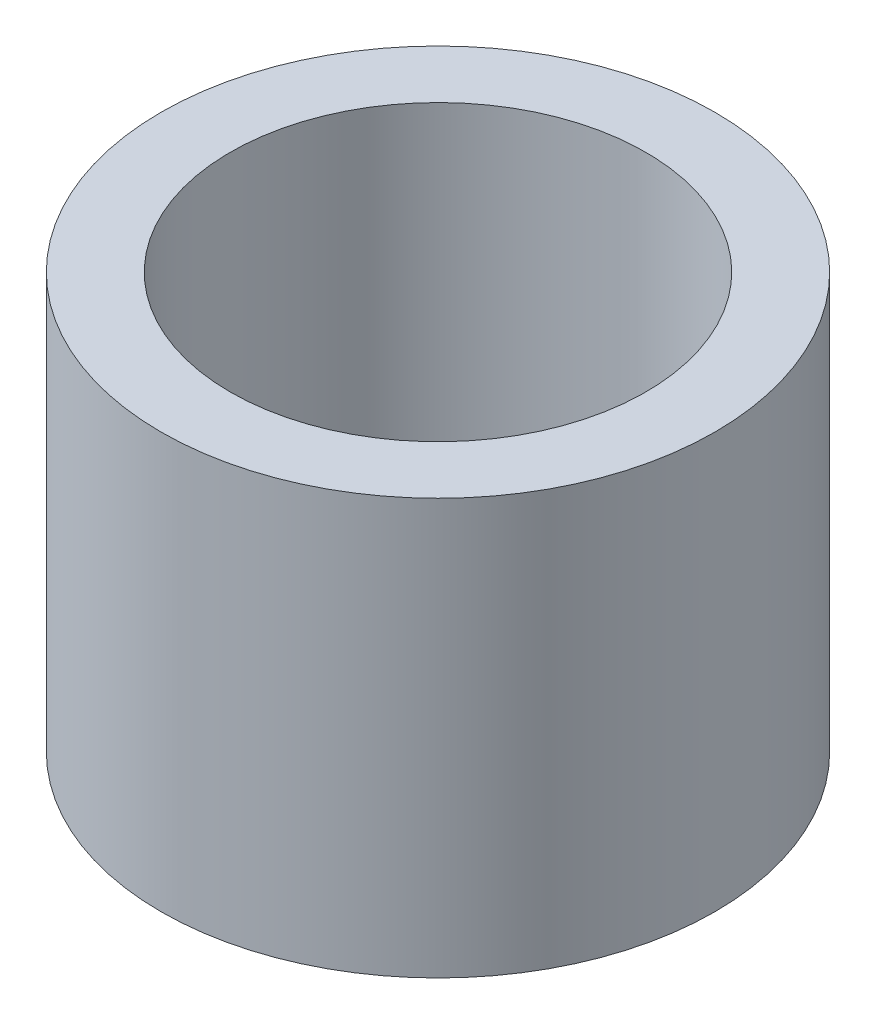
SolidWorks part; units mm, degrees
ref_plane "Front Plane" through (0, 0, 0) normal (0, 0, 1) x (1, 0, 0)
ref_plane "Top Plane" through (0, 0, 0) normal (0, 1, 0) x (1, 0, 0)
ref_plane "Right Plane" through (0, 0, 0) normal (1, 0, 0) x (0, 0, -1)
sketch "Sketch1" plane through (0, 0, 0) normal (0, 1, 0) x (1, 0, 0)
  circle A0 centre (0, 0) radius 1.5
  circle A1 centre (0, 0) radius 2
  dimension "D1" = 3
  dimension "D2" = 4
extrude "Boss-Extrude1" add sketch "Sketch1" along normal blind 3
sketch "Sketch2" plane through (0, 0, 0) normal (0, -1, 0) x (1, 0, 0)
  line L0 (0, 0) -> (0, 2) construction
  circle A0 centre (0, 0) radius 2 construction
